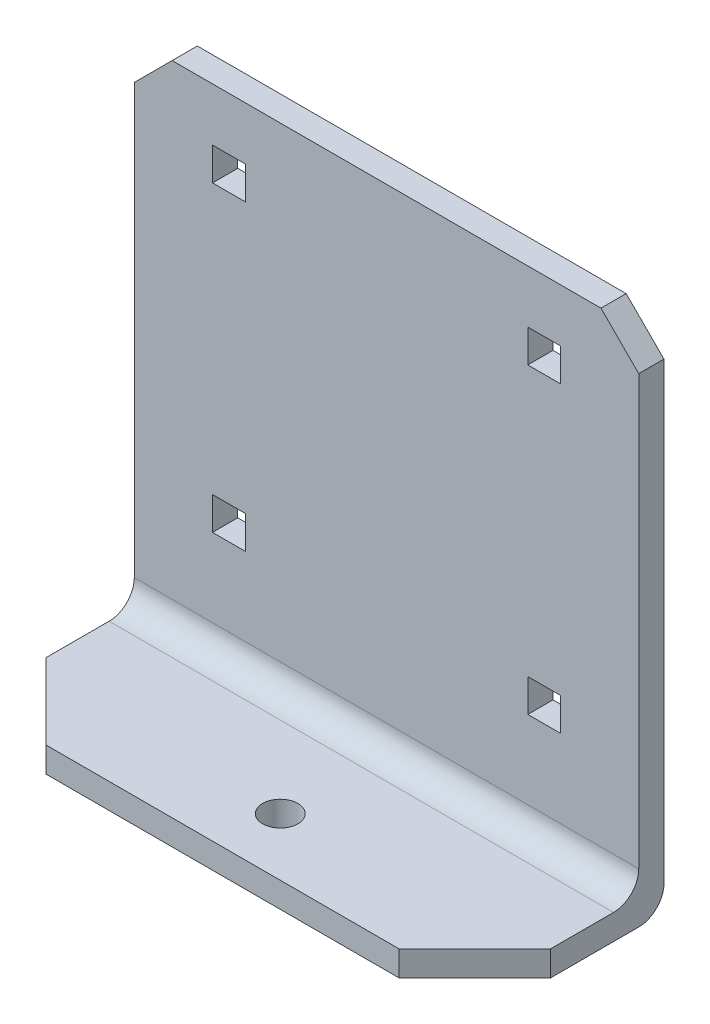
SolidWorks part; units mm, degrees
ref_plane "Front" through (0, 0, 0) normal (0, 0, 1) x (1, 0, 0)
ref_plane "Top" through (0, 0, 0) normal (0, 1, 0) x (1, 0, 0)
ref_plane "Right" through (0, 0, 0) normal (1, 0, 0) x (0, 0, -1)
sketch "Esquisse1" plane through (0, 0, 0) normal (0, 0, 1) x (1, 0, 0)
  line L0 (-85, 97.5) -> (-100, 82.5)
  line L1 (-85, 97.5) -> (85, 97.5)
  line L2 (-100, 82.5) -> (-100, -107.5)
  line L3 (-100, -107.5) -> (100, -107.5)
  line L4 (100, 82.5) -> (100, -107.5)
  line L5 (85, 97.5) -> (100, 82.5)
  line L6 (-62.5, 80.592) -> (-62.5, 58.146) construction
  line L7 (-69, 76.5) -> (-56, 76.5)
  line L8 (-69, 76.5) -> (-69, 63.5)
  line L9 (-69, 63.5) -> (-56, 63.5)
  line L10 (-56, 76.5) -> (-56, 63.5)
  line L11 (56, 76.5) -> (69, 76.5)
  line L12 (56, 76.5) -> (56, 63.5)
  line L13 (56, 63.5) -> (69, 63.5)
  line L14 (69, 76.5) -> (69, 63.5)
  line L15 (56, -43.5) -> (69, -43.5)
  line L16 (56, -43.5) -> (56, -56.5)
  line L17 (56, -56.5) -> (69, -56.5)
  line L18 (69, -43.5) -> (69, -56.5)
  line L19 (-69, -43.5) -> (-56, -43.5)
  line L20 (-69, -43.5) -> (-69, -56.5)
  line L21 (-69, -56.5) -> (-56, -56.5)
  line L22 (-56, -43.5) -> (-56, -56.5)
  line L23 (-77.2786, 70) -> (-55.4738, 70) construction
  line L24 (62.5, 80.592) -> (62.5, 58.146) construction
  line L25 (73.0031, 70) -> (43.7164, 70) construction
  line L26 (62.5, -39.1203) -> (62.5, -60.4975) construction
  line L27 (73.0031, -50) -> (43.7164, -50) construction
  line L28 (-62.5, -33.6264) -> (-62.5, -65.906) construction
  line L29 (-42.9882, -50) -> (-83.3911, -50) construction
  point P0 (-100, 97.5)
  point P3 (100, 97.5)
  dimension "D1" = 200
  dimension "D2" = 100
  dimension "D3" = 205
  dimension "D4" = 97.5
  dimension "D5" = 15
  dimension "D6" = 45
  dimension "D7" = 15
  dimension "D8" = 45
  dimension "D9" = 13
  dimension "D10" = 13
  dimension "D11" = 6.5
  dimension "D12" = 6.5
  dimension "D13" = 13
  dimension "D14" = 6.5
  dimension "D15" = 13
  dimension "D16" = 6.5
  dimension "D17" = 13
  dimension "D18" = 6.5
  dimension "D19" = 13
  dimension "D20" = 6.5
  dimension "D21" = 13
  dimension "D22" = 6.5
  dimension "D23" = 13
  dimension "D24" = 6.5
  dimension "D25" = 27.5
  dimension "D26" = 57.5
  dimension "D27" = 57.5
  dimension "D28" = 125
  dimension "D29" = 37.5
extrude "Base-Extrusion" add sketch "Esquisse1" along normal blind 10
sketch "Esquisse2" plane through (0, 0, 10) normal (0, 0, 1) x (1, 0, 0)
  line L0 (-100, 82.5) -> (-100, -107.5) construction
  line L1 (-100, -97.5) -> (100, -97.5)
  line L2 (-100, -97.5) -> (-100, -107.5)
  line L3 (-100, -107.5) -> (100, -107.5)
  line L4 (100, -97.5) -> (100, -107.5)
  dimension "D1" = 10
extrude "Boss.-Extru.1" add sketch "Esquisse2" along normal blind 65
fillet "Congé1" radius 10
fillet "Congé2" radius 10
chamfer "Chanfrein3" distance 30 angle 45
chamfer "Chanfrein4" distance 30 angle 45
sketch "Esquisse3" plane through (0, -97.5, 0) normal (0, 1, 0) x (-1, 0, 0)
  line L0 (-100, 45) -> (-100, 20) construction
  circle A0 centre (0, 52.1321) radius 7
  dimension "D2" = 14
  dimension "D1" = 100
extrude "Enlèv. mat.-Extru.1" cut sketch "Esquisse3" against normal through all
